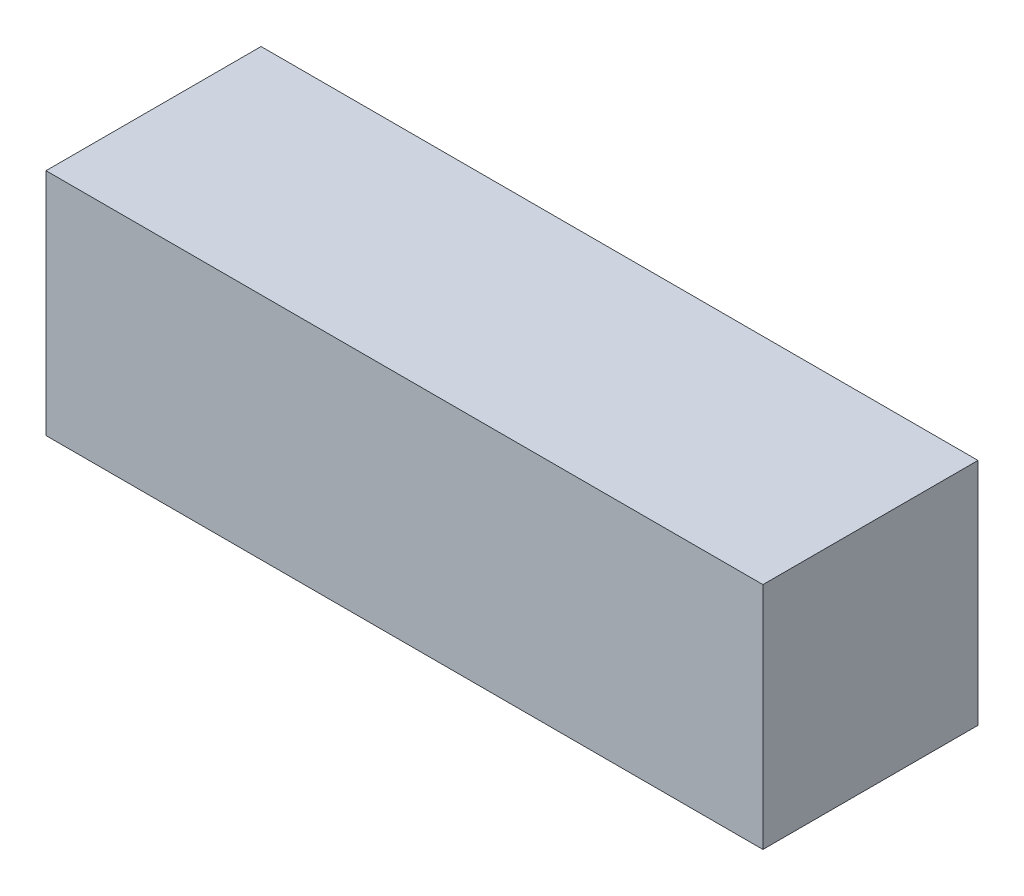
SolidWorks part; units mm, degrees
ref_plane "Front Plane" through (0, 0, 0) normal (0, 0, 1) x (1, 0, 0)
ref_plane "Top Plane" through (0, 0, 0) normal (0, 1, 0) x (1, 0, 0)
ref_plane "Right Plane" through (0, 0, 0) normal (1, 0, 0) x (0, 0, -1)
sketch "Sketch2" plane through (0, 0, 0) normal (0, 0, 1) x (1, 0, 0)
  line L1 (0, 0) -> (10, 0)
  line L2 (0, 0) -> (0, 3.2)
  line L3 (0, 3.2) -> (10, 3.2)
  line L4 (10, 0) -> (10, 3.2)
extrude "Boss-Extrude1" add sketch "Sketch2" along normal blind 3
equation "\"D2@Sketch2\"=10"
equation "\"D1@Sketch2\"=3.2"
